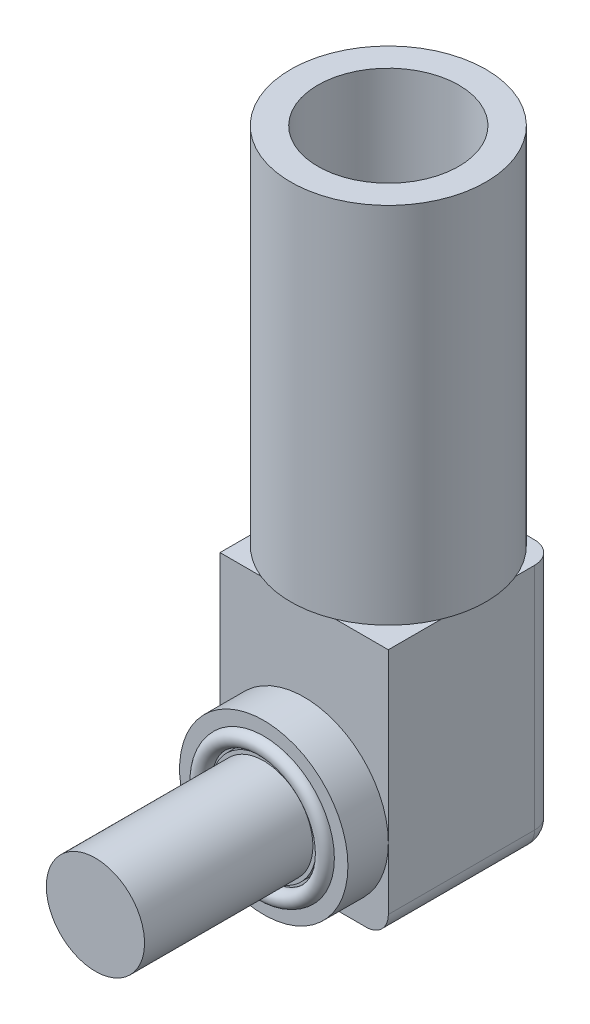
SolidWorks part; units mm, degrees
ref_plane "Front" through (0, 0, 0) normal (0, 0, 1) x (1, 0, 0)
ref_plane "Top" through (0, 0, 0) normal (0, 1, 0) x (1, 0, 0)
ref_plane "Right" through (0, 0, 0) normal (1, 0, 0) x (0, 0, -1)
sketch "Sketch1" plane through (0, 0, 0) normal (0, 1, 0) x (1, 0, 0)
  line L0 (9.525, -9.525) -> (-9.525, 9.525) construction
  line L1 (0, 10.9985) -> (-9.525, 5.4993) construction
  line L2 (-9.525, 5.4993) -> (-9.525, -5.4993) construction
  line L3 (-9.525, -5.4993) -> (0, -10.9985) construction
  line L4 (0, -10.9985) -> (9.525, -5.4993) construction
  line L5 (9.525, -5.4993) -> (9.525, 5.4993) construction
  line L6 (9.525, 5.4993) -> (0, 10.9985) construction
  line L7 (-9.525, 9.525) -> (9.525, 9.525)
  line L8 (-9.525, 9.525) -> (-9.525, -9.525)
  line L9 (-9.525, -9.525) -> (9.525, -9.525)
  line L10 (9.525, 9.525) -> (9.525, -9.525)
  circle A0 centre (0, 0) radius 9.525 construction
  dimension "D1" = 19.05
  dimension "D2" = 19.05
  dimension "D3" = 19.05
extrude "Extrude1" add sketch "Sketch1" along normal blind 28.448
sketch "Sketch2" plane through (0, 0, 0) normal (0, 0, 1) x (1, 0, 0)
  line L0 (0, 0) -> (0, -1.8388) construction
  line L1 (8.8011, 28.448) -> (8.8011, 32.2326)
  line L3 (8.8011, 32.2326) -> (9.398, 32.2326)
  line L4 (9.398, 32.2326) -> (9.398, 33.8074)
  line L5 (9.398, 33.8074) -> (8.8011, 33.8074)
  line L6 (8.8011, 33.8074) -> (8.8011, 35.4584)
  line L7 (8.8011, 35.4584) -> (9.398, 35.4584)
  line L8 (9.398, 35.4584) -> (9.398, 37.0332)
  line L9 (9.398, 37.0332) -> (8.8011, 37.0332)
  line L10 (8.8011, 37.0332) -> (8.8011, 37.846)
  line L11 (8.8011, 37.846) -> (0, 37.846)
  line L12 (0, 37.846) -> (0, 28.448)
  line L13 (-9.398, 32.2326) -> (-9.398, 33.8074) construction
  line L14 (-8.8011, 28.448) -> (-8.8011, 32.2326) construction
  line L15 (8.8011, 28.448) -> (0, 28.448)
  line L16 (9.525, 28.448) -> (-9.525, 28.448) construction
  dimension "D1" = 17.6022
  dimension "D2" = 18.796
  dimension "D3" = 1.5748
  dimension "D4" = 1.651
  dimension "D5" = 0.8128
  dimension "D6" = 9.398
revolve "Revolve1" add sketch "Sketch2" angle 360 about L0
sketch "Sketch3" plane through (0, 37.846, 0) normal (0, 1, 0) x (-1, 0, 0)
  circle A0 centre (0, 0) radius 7.874
  dimension "D1" = 15.748
extrude "Extrude2" add sketch "Sketch3" along normal blind 3.81
sketch "Sketch4" plane through (0, 41.656, 0) normal (0, 1, 0) x (-1, 0, 0)
  circle A0 centre (0, 4.445) radius 1.4605
  circle A1 centre (0, 0) radius 4.445 construction
  dimension "D1" = 2.921
  dimension "D2" = 8.89
extrude "Extrude3" add sketch "Sketch4" along normal blind 9.652
sketch "Sketch5" plane through (0, 51.308, 0) normal (0, 1, 0) x (-1, 0, 0)
  circle A0 centre (0, 4.445) radius 0.9906
  circle A1 centre (0, 4.445) radius 1.4605 construction
  dimension "D1" = 1.9812
extrude "Extrude4" add sketch "Sketch5" along normal blind 4.699
pattern_circular "CirPattern1" count 6 every 60 about axis through (0, 0, 0) along (0, 1, 0) of "Extrude3", "Extrude4"
sketch "1" plane through (0.0995, 41.656, 4.4802) normal (0, 1, 0) x (-1, 0, 0)
  circle A0 centre (0.0995, -4.4802) radius 1.4605
  dimension "D1" = 2.921
extrude "Extrude5" add sketch "1" along normal up to surface (9.652 mm away)
sketch "2" plane through (0.0995, 51.308, 4.4802) normal (0, 1, 0) x (-1, 0, 0)
  circle A0 centre (0.0995, -4.4802) radius 0.9906
  dimension "D1" = 1.9812
extrude "Extrude6" add sketch "2" along normal up to surface (4.699 mm away)
sketch "Sketch10" plane through (0, 0, 9.525) normal (0, 0, 1) x (1, 0, 0)
  line L0 (-9.525, 0) -> (9.525, 0) construction
  circle A0 centre (0, 9.525) radius 9.525
  dimension "D1" = 19.05
extrude "Extrude8" add sketch "Sketch10" along normal blind 4.572
sketch "Sketch11" plane through (0, 0, 14.097) normal (0, 0, 1) x (1, 0, 0)
  circle A0 centre (0, 9.525) radius 7.9885
  circle A1 centre (0, 9.525) radius 5.9565
  circle A2 centre (0, 9.525) radius 9.525 construction
  dimension "D1" = 15.977
  dimension "D2" = 11.913
extrude "Cut-Extrude1" cut sketch "Sketch11" against normal blind 1.27
sketch "Sketch8" plane through (0, 12.8, 14.097) normal (0, 0, -1) x (1, 0, 0)
  circle A0 centre (0, 3.275) radius 5.5562
  circle A1 centre (0, 3.275) radius 9.525 construction
  dimension "D1" = 11.1125
extrude "Extrude7" add sketch "Sketch8" against normal blind 19.05
sketch "Sketch9" plane through (0, -0.126, 0.126) normal (1, 0, 0) x (0, 1, 0)
  line L0 (9.651, 13.1375) -> (9.651, 9.5261) construction
  line L1 (19.176, 13.971) -> (0.126, 13.971) construction
  line L2 (9.651, 13.971) -> (9.651, 9.399) construction
  circle A0 centre (16.751, 13.971) radius 0.89
  circle A1 centre (2.551, 13.971) radius 0.89 construction
  dimension "D1" = 1.78
  dimension "D2" = 12.42
revolve "o-ring 12.42x1.78" add sketch "Sketch9" angle 360 about L0
fillet "Fillet1" radius 2.5 5 edges at (9.525, 0, 0) (0, 0, -9.525) (-9.525, 0, 0) (-9.525, 14.224, -9.525) (9.525, 14.224, -9.525)
sketch "Sketch12" plane through (0, 0, 0) normal (0, 0, 1) x (1, 0, 0)
  line L0 (7.9756, 70.2842) -> (7.9756, 38.4096)
  line L2 (9.7558, 38.4096) -> (7.9756, 38.4096)
  line L3 (9.7558, 38.4096) -> (9.7558, 35.3846)
  line L4 (9.7558, 35.3846) -> (9.0805, 35.3846)
  line L5 (9.0805, 35.3846) -> (9.0805, 33.8606)
  line L6 (9.0805, 33.8606) -> (9.7558, 33.8606)
  line L7 (9.7558, 33.8606) -> (9.7558, 32.2096)
  line L8 (9.7558, 32.2096) -> (9.0805, 32.2096)
  line L9 (9.0805, 32.2096) -> (9.0805, 29.1362)
  line L10 (9.0805, 29.1362) -> (11.049, 29.1362)
  line L11 (11.049, 29.1362) -> (11.049, 70.2842)
  line L12 (11.049, 70.2842) -> (7.9756, 70.2842)
  line L13 (0, 0) -> (0, 12.3432) construction
  dimension "D1" = 41.148
  dimension "D2" = 1.524
  dimension "D3" = 1.651
  dimension "D4" = 3.0734
  dimension "D5" = 22.098
  dimension "D6" = 19.5115
  dimension "D7" = 15.9512
  dimension "D8" = 18.161
revolve "Locking Sleeve" add sketch "Sketch12" angle 360 about L13
